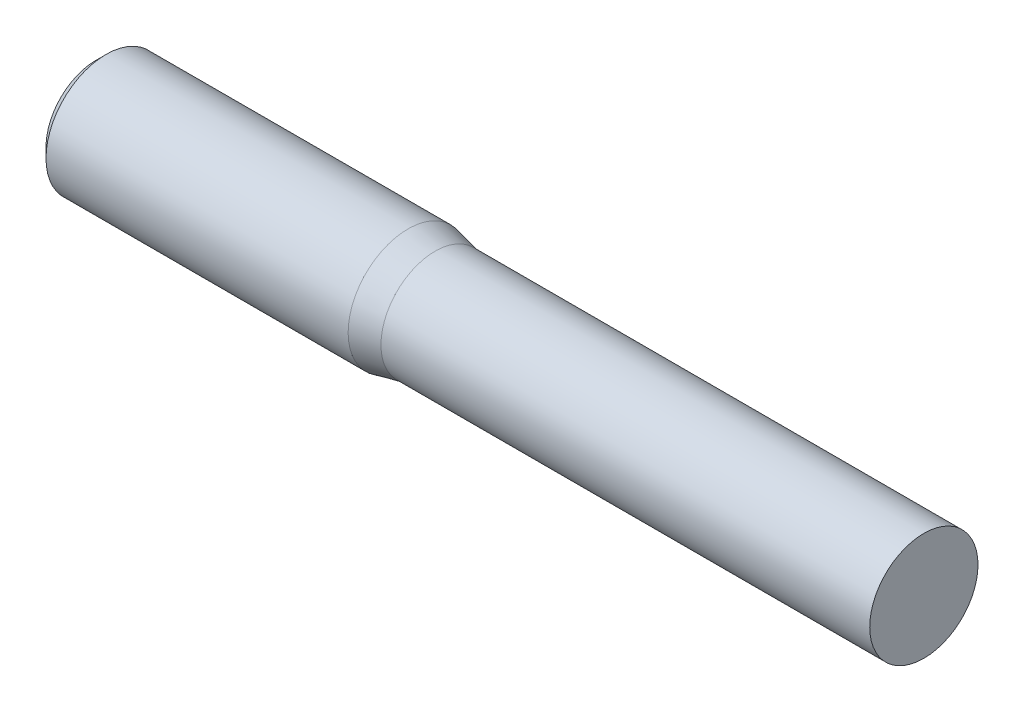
SolidWorks part; units mm, degrees
ref_plane "Front" through (0, 0, 0) normal (0, 0, 1) x (1, 0, 0)
ref_plane "Top" through (0, 0, 0) normal (0, 1, 0) x (1, 0, 0)
ref_plane "Right" through (0, 0, 0) normal (1, 0, 0) x (0, 0, -1)
sketch "Sketch1" plane through (0, 0, 0) normal (0, 0, 1) x (1, 0, 0)
  line L0 (0, 0) -> (25.0352, 0) construction
  line L1 (0, 0) -> (0, 5)
  line L2 (0, 5) -> (26, 5)
  line L3 (26, 5) -> (28.25, 4.513)
  line L4 (28.25, 4.513) -> (65, 4.513)
  line L5 (65, 4.513) -> (65, 0)
  line L7 (0, 0) -> (65, 0)
  dimension "l1" = 65
  dimension "D2" = 9.026
  dimension "d" = 10
  dimension "b" = 26
  dimension "x" = 2.25
revolve "Base" add sketch "Sketch1" angle 360 about L0
chamfer "HeadChamfer" distance 0.812 angle 45 1 edges at (0, 0, 5)
sketch "Sketch2" plane through (65, 0, 0) normal (1, 0, 0) x (0, 0, -1)
  circle A0 centre (0, 0) radius 4.513 construction
  circle A1 centre (0, 0) radius 4.513
extrude "BaseEnd" add sketch "Sketch2" along normal blind 4
sketch "Sketch3" plane through (0, 0, 0) normal (0, 0, 1) x (1, 0, 0)
  line L0 (0.812, 4.2968) -> (1.218, 5)
  line L1 (1.218, 5) -> (1.218, 5.5)
  line L2 (1.218, 5.5) -> (0.406, 5.5)
  line L3 (0.406, 5.5) -> (0.406, 5)
  line L4 (0.406, 5) -> (0.812, 4.2968)
  line L5 (0, 0) -> (6.1546, 0) construction
  line L6 (0.812, 5) -> (0.812, -5) construction
  dimension "D1" = 60
  dimension "D2" = 0.812
  dimension "D3" = 0.5
  dimension "D4" = 10
  dimension "D5" = 60
revolve "Cut-Revolve10" [suppressed] cut sketch "Sketch3" angle 360 about L5
pattern_linear "LPattern10" [suppressed] count 27 spacing 0.9744 along (1, 0, 0)
equation "\"D1@HeadChamfer\" =  ( \"d@Sketch1\" - \"D2@ThreadCosmetic1\" )  / 2"
equation "\"D4@Sketch3\" = \"d@Sketch1\""
equation "\"D2@Sketch3\" =  ( \"d@Sketch1\" - \"D2@ThreadCosmetic1\" )  / 2"
equation "\"D3@LPattern10\" = \"D2@Sketch3\" * 1.2"
equation "\"D1@LPattern10\" = \"b@Sketch1\" / \"D3@LPattern10\""
